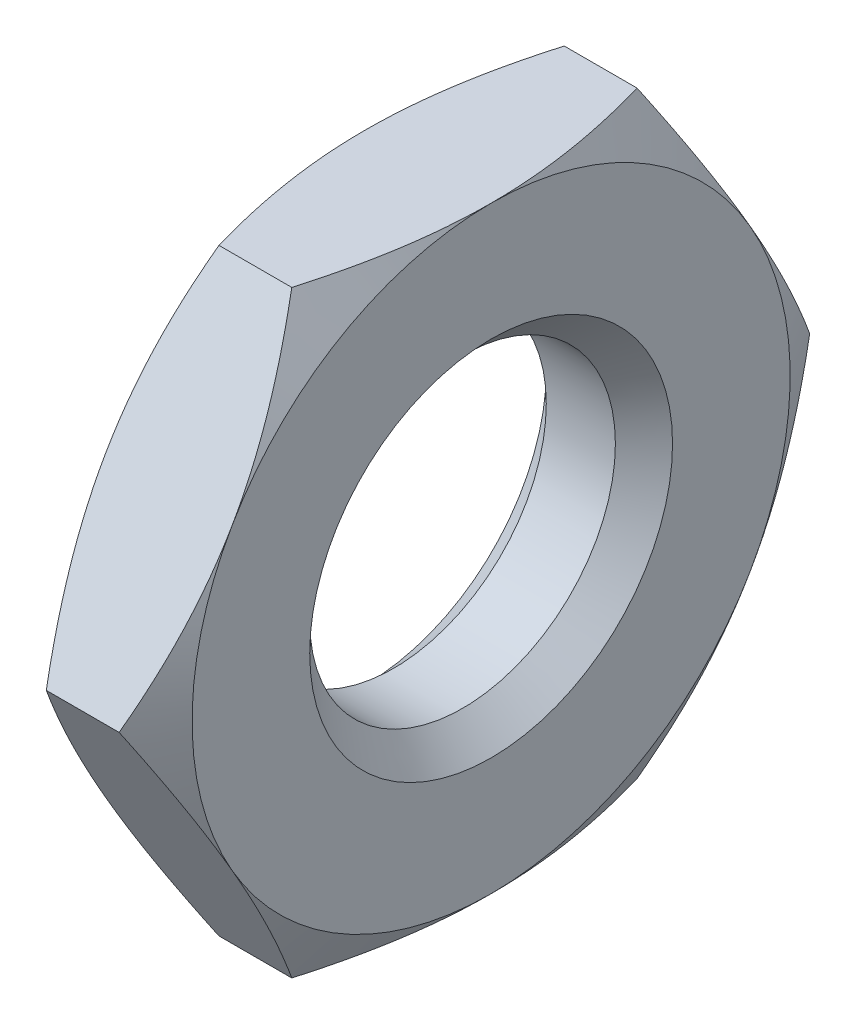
SolidWorks part; units mm, degrees
ref_plane "Front Plane" through (0, 0, 0) normal (0, 0, 1) x (1, 0, 0)
ref_plane "Top Plane" through (0, 0, 0) normal (0, 1, 0) x (1, 0, 0)
ref_plane "Right Plane" through (0, 0, 0) normal (1, 0, 0) x (0, 0, -1)
sketch "Sketch1" plane through (0, 0, 0) normal (1, 0, 0) x (0, 0, -1)
  line L1 (1.299, 2.25) -> (-1.299, 2.25)
  line L2 (-1.299, 2.25) -> (-2.5981, 0)
  line L3 (-2.5981, 0) -> (-1.299, -2.25)
  line L4 (-1.299, -2.25) -> (1.299, -2.25)
  line L5 (1.299, -2.25) -> (2.5981, 0)
  line L6 (2.5981, 0) -> (1.299, 2.25)
  circle A0 centre (0, 0) radius 2.25 construction
  circle A1 centre (0, 0) radius 1.15
extrude "Extrude1" add sketch "Sketch1" along normal blind 0.95
sketch "Sketch2" plane through (0, 0, 0) normal (0, 0, 1) x (1, 0, 0)
  line L0 (0.95, 2.25) -> (0.95, 9)
  line L1 (0.95, 9) -> (0, 9)
  line L2 (0, 9) -> (0, 2.25)
  line L3 (0, 2.25) -> (0.475, 3.0727)
  line L4 (0.475, 3.0727) -> (0.95, 2.25)
revolve "Cut-Revolve1" cut sketch "Sketch2" angle 360 about axis through (0.95, 0, 0) along (-1, 0, 0)
chamfer "Chamfer1" distance 0.215 angle 45 2 edges at (0, 0, -1.15) (0.95, 0, -1.15)
equation "\"D2@Sketch2\"=\"D1@Sketch1\"*2"
